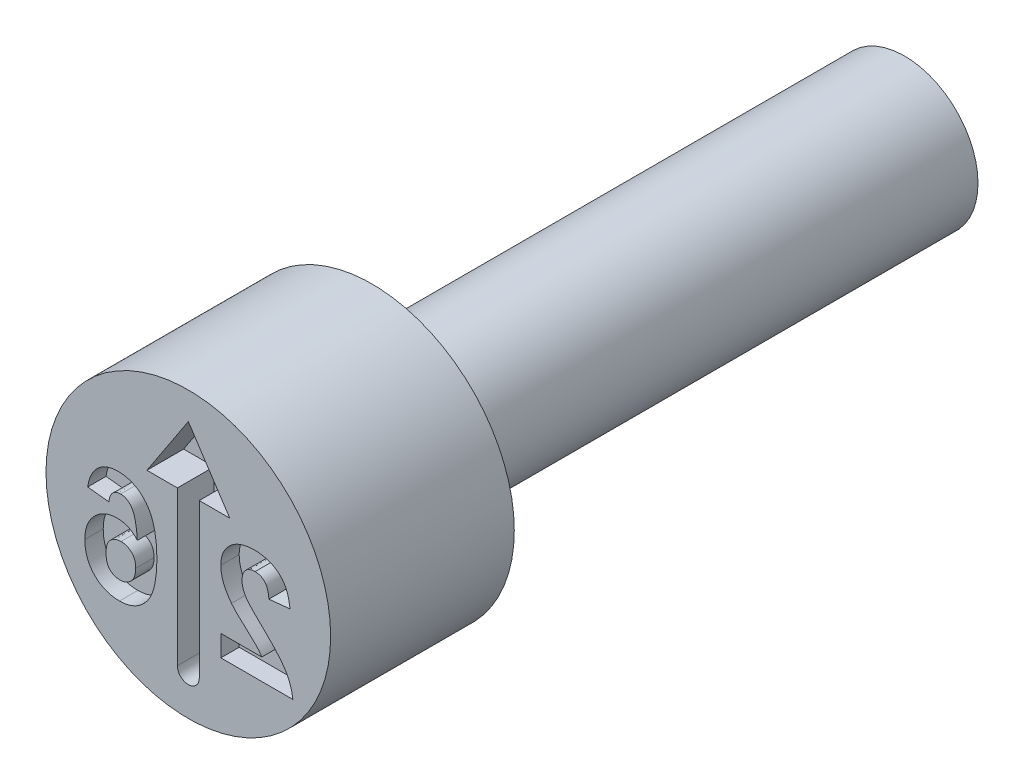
SolidWorks part; units mm, degrees
ref_plane "Front Plane" through (0, 0, 0) normal (0, 0, 1) x (1, 0, 0)
ref_plane "Top Plane" through (0, 0, 0) normal (0, 1, 0) x (1, 0, 0)
ref_plane "Right Plane" through (0, 0, 0) normal (1, 0, 0) x (0, 0, -1)
sketch "Sketch2" plane through (0, 0, 0) normal (1, 0, 0) x (0, 0, -1)
  line L0 (0.4039, 0) -> (50000.4039, 0) construction
  line L6 (0, 1.55) -> (0, 0)
  line L7 (2, 1.55) -> (0, 1.55)
  line L8 (2, 0.8) -> (2, 1.55)
  line L9 (7.8, 0.8) -> (2, 0.8)
  line L10 (7.8, 0) -> (7.8, 0.8)
  line L11 (0, 0) -> (7.8, 0)
  dimension "D1" = 3.1
  dimension "D2" = 1.6
  dimension "D3" = 7.8
  dimension "D4" = 2
revolve "Revolve1" add sketch "Sketch2" angle 360 about L0
sketch "Sketch3" plane through (0, 0, 0) normal (0, 0, 1) x (1, 0, 0)
  line L0 (0, 0) -> (0, 62500) construction
  line L1 (0.119, 0.5665) -> (0.119, -1.1101)
  line L2 (0.4512, 0.5665) -> (0.119, 0.5665)
  line L3 (0, 1.2513) -> (0.4512, 0.5665)
  line L15 (0, 1.2513) -> (-0.4512, 0.5665)
  line L16 (-0.4512, 0.5665) -> (-0.119, 0.5665)
  line L17 (-0.119, 0.5665) -> (-0.119, -1.1101)
  arc A2 (-0.119, -1.1101) -> (0.119, -1.1101) centre (0, -1.1101) ccw
extrude "Cut-Extrude4" cut sketch "Sketch3" against normal blind 0.4
sketch "Sketch4" plane through (0, 0, 0) normal (0, 0, 1) x (1, 0, 0)
  text T0 "2  6" font "Arial" height 1.2
  dimension "D1" = 0.8
  dimension "D2" = 1.2
extrude "Cut-Extrude5" cut sketch "Sketch4" against normal blind 0.2
